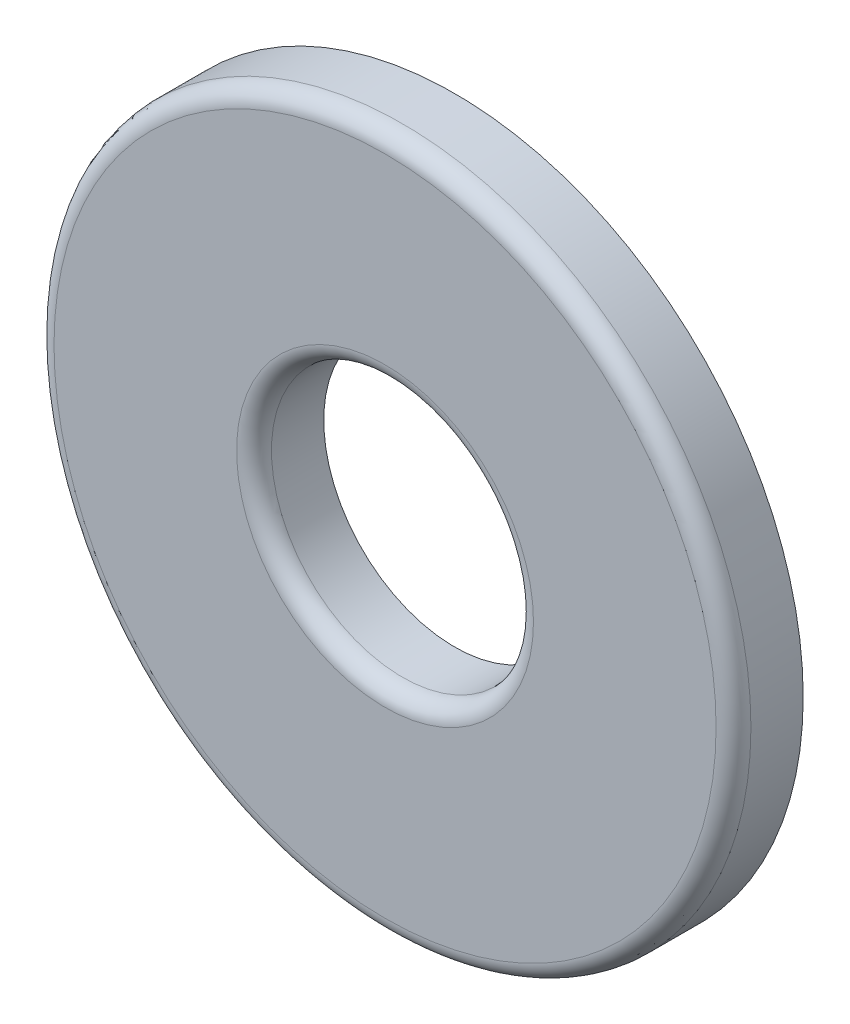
SolidWorks part; units mm, degrees
other "Imported1" parameters "D1"=0.1588, "TH"=1.0287, "Thickness"=0.635
ref_plane "Front Plane" through (0, 0, 0) normal (0, 0, 1) x (1, 0, 0)
ref_plane "Top Plane" through (0, 0, 0) normal (0, 1, 0) x (1, 0, 0)
ref_plane "Right Plane" through (0, 0, 0) normal (1, 0, 0) x (0, 0, -1)
sketch "Sketch1" plane through (0, 0, 0) normal (0, 0, 1) x (1, 0, 0)
  line L0 (-3.175, 0) -> (3.175, 0) construction
  line L1 (-1.1938, 0) -> (1.1938, 0) construction
  circle A0 centre (0, 0) radius 1.1938 construction
  circle A1 centre (0, 0) radius 3.175 construction
  point P8 (0, 0)
  point P9 (0, 3.175)
  point P11 (1.1938, 0)
  dimension "ID" = 2.3876
  dimension "OD" = 6.35
sketch "Sketch2" plane through (0, 0, 0) normal (1, 0, 0) x (0, 0, -1)
  line L0 (-0.3175, 3.175) -> (0.3175, 3.175) construction
  point P2 (0, 3.175)
sketch "Sketch3" plane through (0, 0, 0) normal (0, 0, 1) x (1, 0, 0)
  circle A0 centre (0, 0) radius 1.1938
  circle A1 centre (0, 0) radius 3.175
extrude "Boss-Extrude1" add sketch "Sketch3" along normal up to vertex (0.3175 mm away) and the other way up to vertex (0.3175 mm away)
fillet "Fillet1" radius 0.1588 2 edges at (3.175, 0, 0.3175) (1.1938, 0, 0.3175)
equation "\"D1@Fillet1\"=\"Thickness@Sketch2\"/4"
